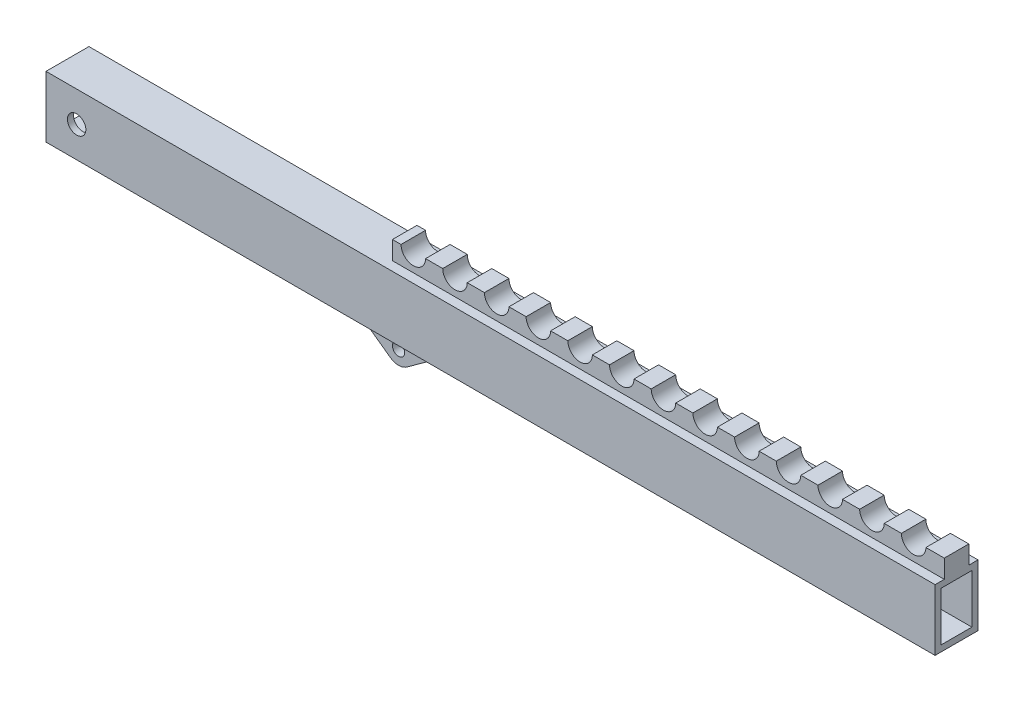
SolidWorks part; units mm, degrees
ref_plane "Plan de face" through (0, 0, 0) normal (0, 0, 1) x (1, 0, 0)
ref_plane "Plan de dessus" through (0, 0, 0) normal (0, 1, 0) x (1, 0, 0)
ref_plane "Plan de droite" through (0, 0, 0) normal (1, 0, 0) x (0, 0, -1)
sketch "Esquisse1" plane through (0, 0, 0) normal (0, 0, 1) x (1, 0, 0)
  line L1 (-68.8795, 11.6498) -> (1381.1205, 11.6498)
  line L2 (-68.8795, 11.6498) -> (-68.8795, -88.3502)
  line L3 (-68.8795, -88.3502) -> (1381.1205, -88.3502)
  line L4 (1381.1205, 11.6498) -> (1381.1205, -88.3502)
  dimension "D1" = 1450
  dimension "D2" = 100
extrude "Extrusion1" add sketch "Esquisse1" along normal mid plane 70
shell "Coque1" thickness 10
sketch "Esquisse2" plane through (0, 0, 35) normal (0, 0, 1) x (1, 0, 0)
  line L0 (-68.8795, 11.6498) -> (-68.8795, -88.3502) construction
  line L1 (1381.1205, 11.6498) -> (-68.8795, 11.6498) construction
  circle A0 centre (-18.8795, -38.3502) radius 15
  dimension "D1" = 50
  dimension "D2" = 50
extrude "Perçage" cut sketch "Esquisse2" against normal through all
sketch "Esquisse3" plane through (0, 0, 0) normal (0, 0, 1) x (1, 0, 0)
  line L0 (481.1205, 156.217) -> (481.1205, -299.3549) construction
  line L1 (1381.1205, -38.3502) -> (-109.098, -38.3502) construction
  line L2 (1381.1205, -88.3502) -> (1381.1205, 11.6498) construction
  line L3 (358.3378, -118.3502) -> (640.6975, -118.3502) construction
  line L4 (-68.8795, -88.3502) -> (1381.1205, -88.3502) construction
  line L5 (400.4781, -88.3502) -> (561.7629, -88.3502)
  line L6 (400.4781, -88.3502) -> (467.8, -136.8429)
  line L7 (561.7629, -88.3502) -> (494.441, -136.8429)
  circle A0 centre (481.1205, -118.3502) radius 10
  arc A1 (467.8, -136.8429) -> (494.441, -136.8429) centre (481.1205, -118.3502) ccw
  dimension "D1" = 550
  dimension "D2" = 80
extrude "Patte inférieure" add sketch "Esquisse3" along normal mid plane 20
sketch "Esquisse4" plane through (0, 0, 0) normal (0, 0, 1) x (1, 0, 0)
  line L0 (1381.1205, 11.6498) -> (-68.8795, 11.6498) construction
  line L1 (481.1205, 11.6498) -> (1381.1205, 11.6498)
  line L2 (481.1205, 11.6498) -> (481.1205, 41.6498)
  line L3 (481.1205, 41.6498) -> (495.1205, 41.6498)
  line L4 (1381.1205, 11.6498) -> (1381.1205, 41.6498)
  line L5 (1331.1205, 347.7241) -> (1331.1205, -238.3502) construction
  line L6 (535.1205, 41.6498) -> (563.1205, 41.6498)
  line L7 (1351.1205, 41.6498) -> (1381.1205, 41.6498)
  line L8 (603.1205, 41.6498) -> (631.1205, 41.6498)
  line L9 (671.1205, 41.6498) -> (699.1205, 41.6498)
  line L10 (739.1205, 41.6498) -> (767.1205, 41.6498)
  line L11 (807.1205, 41.6498) -> (835.1205, 41.6498)
  line L12 (875.1205, 41.6498) -> (903.1205, 41.6498)
  line L13 (943.1205, 41.6498) -> (971.1205, 41.6498)
  line L14 (1011.1205, 41.6498) -> (1039.1205, 41.6498)
  line L15 (1079.1205, 41.6498) -> (1107.1205, 41.6498)
  line L16 (1147.1205, 41.6498) -> (1175.1205, 41.6498)
  line L17 (1215.1205, 41.6498) -> (1243.1205, 41.6498)
  line L18 (1283.1205, 41.6498) -> (1311.1205, 41.6498)
  arc A0 (1311.1205, 41.6498) -> (1351.1205, 41.6498) centre (1331.1205, 41.6498) ccw
  arc A1 (1243.1205, 41.6498) -> (1283.1205, 41.6498) centre (1263.1205, 41.6498) ccw
  arc A2 (1175.1205, 41.6498) -> (1215.1205, 41.6498) centre (1195.1205, 41.6498) ccw
  arc A3 (1107.1205, 41.6498) -> (1147.1205, 41.6498) centre (1127.1205, 41.6498) ccw
  arc A4 (1039.1205, 41.6498) -> (1079.1205, 41.6498) centre (1059.1205, 41.6498) ccw
  arc A5 (971.1205, 41.6498) -> (1011.1205, 41.6498) centre (991.1205, 41.6498) ccw
  arc A6 (903.1205, 41.6498) -> (943.1205, 41.6498) centre (923.1205, 41.6498) ccw
  arc A7 (835.1205, 41.6498) -> (875.1205, 41.6498) centre (855.1205, 41.6498) ccw
  arc A8 (767.1205, 41.6498) -> (807.1205, 41.6498) centre (787.1205, 41.6498) ccw
  arc A9 (699.1205, 41.6498) -> (739.1205, 41.6498) centre (719.1205, 41.6498) ccw
  arc A10 (631.1205, 41.6498) -> (671.1205, 41.6498) centre (651.1205, 41.6498) ccw
  arc A11 (563.1205, 41.6498) -> (603.1205, 41.6498) centre (583.1205, 41.6498) ccw
  arc A12 (495.1205, 41.6498) -> (535.1205, 41.6498) centre (515.1205, 41.6498) ccw
  dimension "D4" = 40
  dimension "D1" = 550
  dimension "D2" = 30
  dimension "D3" = 850
extrude "Extrusion3" add sketch "Esquisse4" along normal mid plane 40
